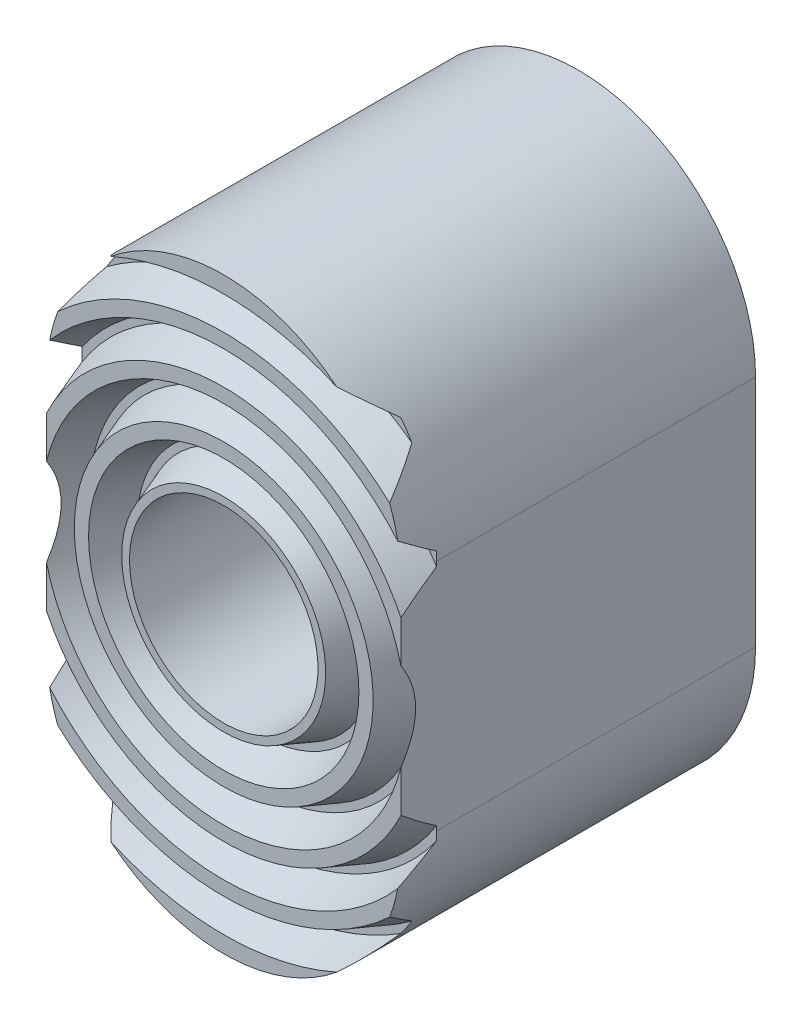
SolidWorks part; units mm, degrees
ref_plane "front" through (0, 0, 0) normal (0, 0, 1) x (1, 0, 0)
ref_plane "top" through (0, 0, 0) normal (0, 1, 0) x (1, 0, 0)
ref_plane "side" through (0, 0, 0) normal (1, 0, 0) x (0, 0, -1)
sketch "Sketch1" plane through (0, 0, 0) normal (0, 0, 1) x (1, 0, 0)
  line L0 (0, -2.5019) -> (0, 2.5019) construction
  line L1 (0, -50) -> (0, 50) construction
  line L2 (-3.7973, -2.5019) -> (-3.7973, 2.5019)
  line L3 (3.7973, -2.5019) -> (3.7973, 2.5019)
  line L4 (50, 0) -> (-50, 0) construction
  arc A0 (-3.7973, -2.5019) -> (3.7973, -2.5019) centre (0, -2.5019) ccw
  arc A1 (3.7973, 2.5019) -> (-3.7973, 2.5019) centre (0, 2.5019) ccw
  point P5 (0, 0)
  point P10 (0, 0)
  point P11 (0, 0)
  dimension "D2" = 12.5984
  dimension "D1" = 7.5946
extrude "Boss-Extrude1" add sketch "Sketch1" along normal blind 7.5946
sketch "Sketch3" plane through (0, 0, 0) normal (1, 0, 0) x (0, 0, -1)
  line L0 (0, 0) -> (-9.9737, 0) construction
  line L1 (0, 2.54) -> (-9.9737, 2.54) construction
  line L2 (0, 3.556) -> (-9.9737, 3.556) construction
  line L3 (0, 4.572) -> (-9.9737, 4.572) construction
  line L4 (0, 5.588) -> (-9.9737, 5.588) construction
  line L6 (-6.8326, 2.4617) -> (-7.5946, 2.1844)
  line L7 (-6.8326, 6.2992) -> (-6.8326, 2.5019)
  line L8 (-6.8326, 5.6663) -> (-6.8326, 5.5097)
  line L9 (-7.5946, 6.2992) -> (-7.5946, 2.5019) construction
  line L10 (-6.8326, 2.6183) -> (-7.5946, 2.8956)
  line L11 (-6.8326, 3.6343) -> (-7.5946, 3.9116)
  line L12 (-6.8326, 3.4777) -> (-7.5946, 3.2004)
  line L13 (-6.8326, 4.6503) -> (-7.5946, 4.9276)
  line L14 (-6.8326, 4.4937) -> (-7.5946, 4.2164)
  line L15 (-6.8326, 5.6663) -> (-7.5946, 5.9436)
  line L16 (-6.8326, 5.5097) -> (-7.5946, 5.2324)
  line L17 (-6.8326, 4.6503) -> (-6.8326, 4.4937)
  line L18 (-6.8326, 3.6343) -> (-6.8326, 3.4777)
  line L19 (-6.8326, 2.6183) -> (-6.8326, 2.4617)
  line L20 (-7.5946, 5.9436) -> (-7.5946, 5.2324)
  line L21 (-7.5946, 4.9276) -> (-7.5946, 4.2164)
  line L22 (-7.5946, 3.9116) -> (-7.5946, 3.2004)
  line L23 (-7.5946, 2.8956) -> (-7.5946, 2.1844)
  dimension "D6" = 0.0783
  dimension "D7" = 20
  dimension "D1" = 2.54
  dimension "D2" = 1.016
  dimension "D3" = 1.016
  dimension "D4" = 1.016
  dimension "D5" = 0.762
  dimension "D8" = 4
revolve "Cut-Revolve1" cut sketch "Sketch3" angle 360 about L0
hole_wizard "#10-32 Tapped Hole1" positions "Sketch4" profile "Sketch5" tap size "#10-32" standard "ANSI Inch"
sketch "Sketch4" plane through (0, 0, 0) normal (0, 0, -1) x (-1, 0, 0)
  point P0 (0, 0)
sketch "Sketch5" plane through (0, 0, 0) normal (1, 0, 0) x (0, 1, 0)
  line L0 (0, 0) -> (0, 7.5946)
  line L1 (0, 7.5946) -> (2.0193, 7.5946)
  line L2 (2.0193, 7.5946) -> (2.0193, 0)
  line L5 (2.0193, 0) -> (0, 0)
  line L11 (0, -6.35) -> (0, 107.95) construction
  dimension "Thru Tap Drill Dia." = 4.0386
  dimension "Thru Tap Drill Depth" = 7.5946
